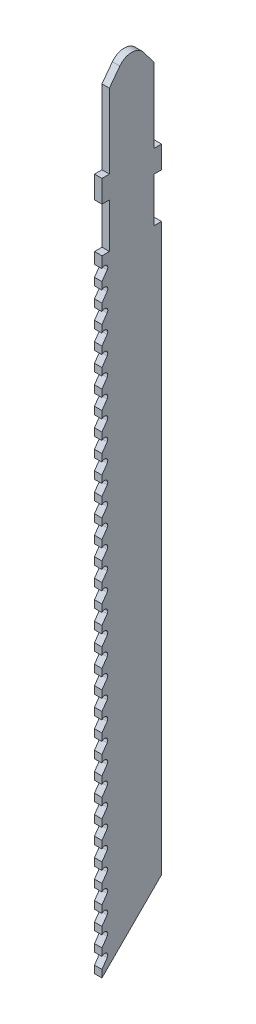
SolidWorks part; units mm, degrees
ref_plane "Front" through (0, 0, 0) normal (0, 0, 1) x (1, 0, 0)
ref_plane "Top" through (0, 0, 0) normal (0, 1, 0) x (1, 0, 0)
ref_plane "Right" through (0, 0, 0) normal (1, 0, 0) x (0, 0, -1)
sketch "Sketch1" plane through (0, 0, 0) normal (1, 0, 0) x (0, 0, -1)
  line L0 (0, 0) -> (0, 23) construction
  line L1 (3, 0) -> (3, 6)
  line L2 (-3, 0) -> (-3, 6)
  line L3 (3, 6) -> (4, 6)
  line L4 (-3, 6) -> (-4, 6)
  line L5 (4, 6) -> (4, 9)
  line L6 (-4, 6) -> (-4, 9)
  line L7 (4, 9) -> (3, 9)
  line L8 (-4, 9) -> (-3, 9)
  line L9 (3, 9) -> (3, 19)
  line L10 (-3, 9) -> (-3, 19)
  line L11 (3, 19) -> (1.6, 20.8667)
  line L12 (-3, 19) -> (-1.6, 20.8667)
  line L13 (3, 0) -> (4, 0)
  line L14 (-4, 0) -> (-3, 0)
  line L15 (-4, 0) -> (-4, -84)
  line L16 (-4, -84) -> (4, -76)
  line L17 (4, 0) -> (4, -76)
  arc A0 (-1.6, 20.8667) -> (1.6, 20.8667) centre (0, 19.6667) cw
  dimension "D9" = 2
  dimension "D1" = 4
  dimension "D2" = 8
  dimension "D3" = 6
  dimension "D4" = 3
  dimension "D5" = 6
  dimension "D6" = 10
  dimension "D7" = 45
  dimension "D8" = 107
extrude "Base-Extrude" add sketch "Sketch1" along normal mid plane 1
sketch "Sketch3" plane through (0, 0, 0) normal (1, 0, 0) x (0, 0, -1)
  line L0 (-4, 0) -> (-4, -84) construction
  line L1 (-4, -81.5) -> (-4, -83)
  line L2 (-4, -83) -> (-3.2952, -81.9935)
  arc A0 (-3.2952, -81.9935) -> (-4, -81.5) centre (-3.6476, -81.7467) ccw
  dimension "D3" = 35
  dimension "D4" = 0.4302
  dimension "D1" = 1
  dimension "D2" = 1.5
extrude "Cut-Extrude1" cut sketch "Sketch3" against normal through all and the other way through all
pattern_linear "LPattern1" count 33 spacing 2.5
